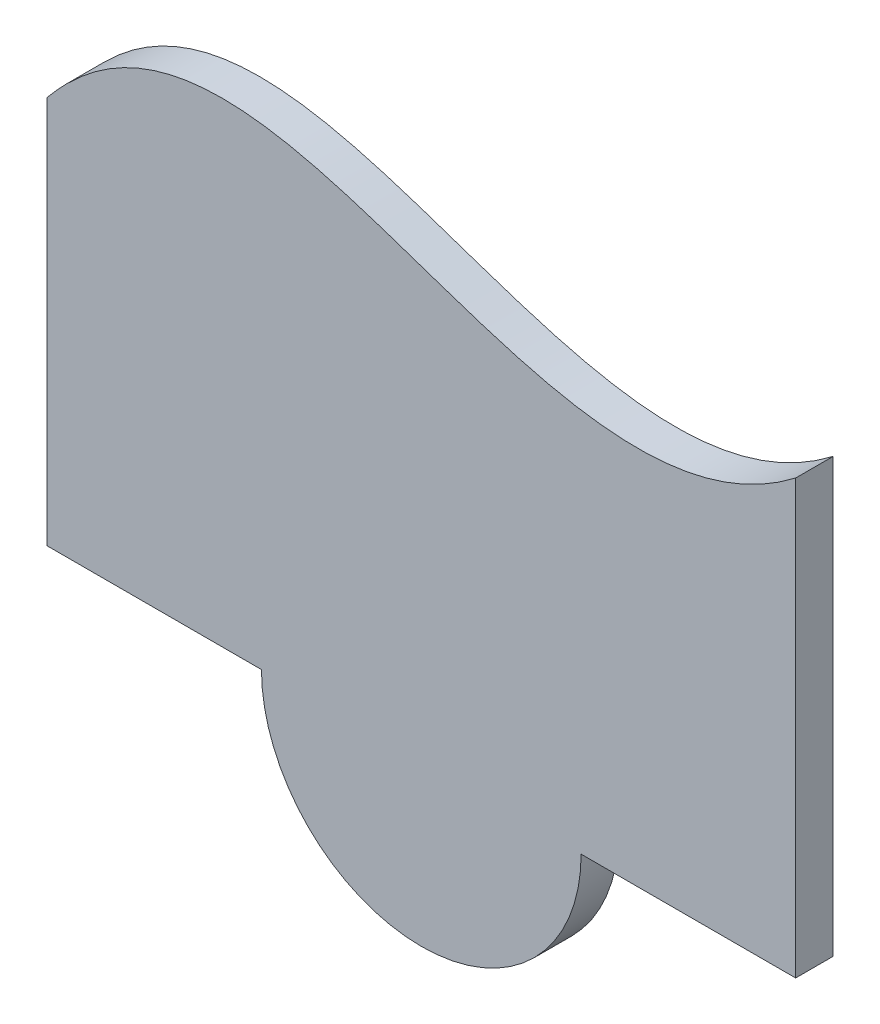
SolidWorks part; units mm, degrees
ref_plane "Front Plane" through (0, 0, 0) normal (0, 0, 1) x (1, 0, 0)
ref_plane "Top Plane" through (0, 0, 0) normal (0, 1, 0) x (1, 0, 0)
ref_plane "Right Plane" through (0, 0, 0) normal (1, 0, 0) x (0, 0, -1)
sketch "Sketch1" plane through (0, 0, 0) normal (0, 0, 1) x (1, 0, 0)
  line L0 (71.3479, 0) -> (100, 0)
  line L1 (0, 0) -> (28.6521, 0)
  line L2 (0, 0) -> (0, 51.8211)
  line L4 (100, 0) -> (100, 57.8293)
  arc A0 (71.3479, 0) -> (28.6521, 0) centre (50, 0) cw
  spline S0 degree 3 poles (0, 51.8211) (27.7325, 85.6344) (66.9714, 32.4966) (100, 57.8293) knots 0 0 0 0 1 1 1 1
  dimension "D1" = 100
extrude "Extrude1" add sketch "Sketch1" along normal blind 5
